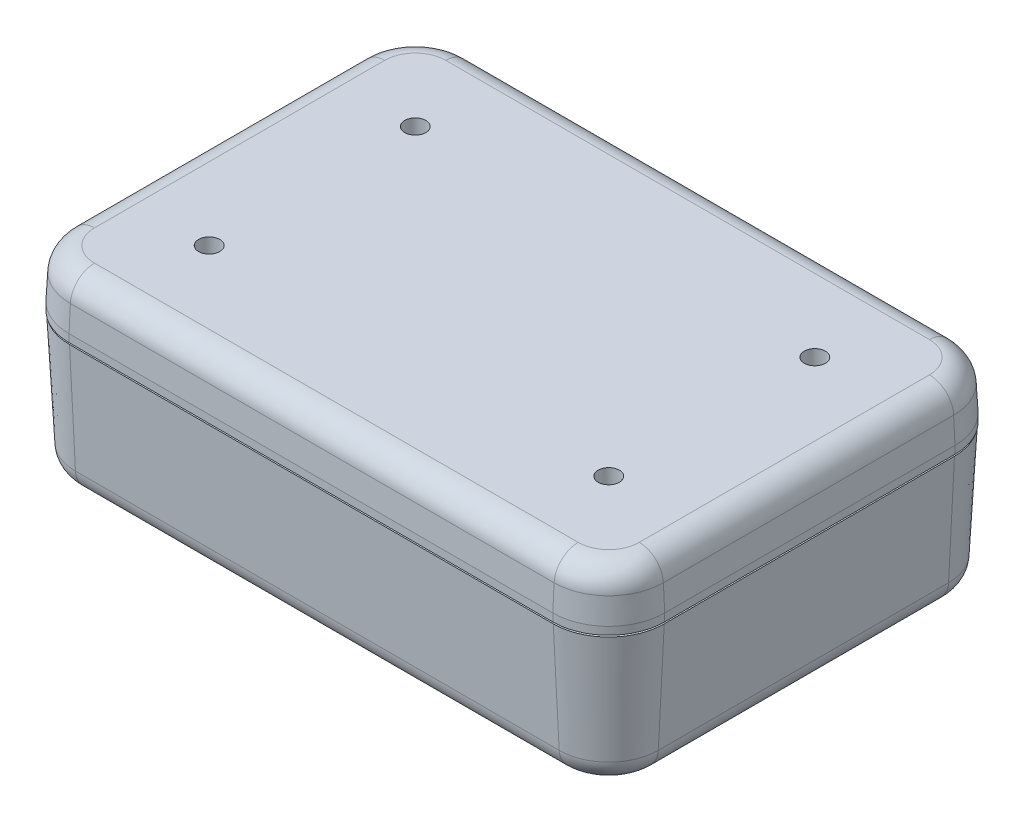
SolidWorks part; units mm, degrees
ref_plane "Front Plane" through (0, 0, 0) normal (0, 0, 1) x (1, 0, 0)
ref_plane "Top Plane" through (0, 0, 0) normal (0, 1, 0) x (1, 0, 0)
ref_plane "Right Plane" through (0, 0, 0) normal (1, 0, 0) x (0, 0, -1)
sketch "Sketch1" plane through (0, 0, 0) normal (0, 1, 0) x (1, 0, 0)
  line L1 (-63.5, -50.8) -> (63.5, -50.8)
  line L2 (-76.2, -38.1) -> (-76.2, 38.1)
  line L3 (-63.5, 50.8) -> (63.5, 50.8)
  line L4 (76.2, -38.1) -> (76.2, 38.1)
  line L5 (-76.2, -50.8) -> (76.2, 50.8) construction
  line L6 (-76.2, 50.8) -> (76.2, -50.8) construction
  arc A0 (-63.5, -50.8) -> (-76.2, -38.1) centre (-63.5, -38.1) cw
  arc A1 (63.5, -50.8) -> (76.2, -38.1) centre (63.5, -38.1) ccw
  arc A2 (63.5, 50.8) -> (76.2, 38.1) centre (63.5, 38.1) cw
  arc A3 (-76.2, 38.1) -> (-63.5, 50.8) centre (-63.5, 38.1) cw
  point P0 (0, 0)
  dimension "D1" = 12.7
  dimension "D3" = 152.4
  dimension "D4" = 101.6
extrude "Boss-Extrude1" add sketch "Sketch1" along normal blind 38.1 draft 3
fillet "Fillet1" radius 6.35 8 edges at (-72.4803, 0, 47.0803) (-76.2, 0, 0) (-72.4803, 0, -47.0803) (0, 0, -50.8) (72.4803, 0, -47.0803) (76.2, 0, 0) (72.4803, 0, 47.0803) (0, 0, 50.8)
shell "Shell1" thickness 3.175
sketch "Sketch2" plane through (0, 38.1, 0) normal (0, 1, 0) x (1, 0, 0)
  line L8 (-63.5, -52.7967) -> (63.5, -52.7967)
  line L9 (78.1967, -38.1) -> (78.1967, 38.1)
  line L10 (63.5, 52.7967) -> (-63.5, 52.7967)
  line L11 (-78.1967, 38.1) -> (-78.1967, -38.1)
  line L12 (-63.5, -52.7967) -> (63.5, -52.7967)
  line L13 (78.1967, -38.1) -> (78.1967, 38.1)
  line L14 (63.5, 52.7967) -> (-63.5, 52.7967)
  line L15 (-78.1967, 38.1) -> (-78.1967, -38.1)
  arc A8 (-78.1967, -38.1) -> (-63.5, -52.7967) centre (-63.5, -38.1) ccw
  arc A9 (63.5, -52.7967) -> (78.1967, -38.1) centre (63.5, -38.1) ccw
  arc A10 (78.1967, 38.1) -> (63.5, 52.7967) centre (63.5, 38.1) ccw
  arc A11 (-63.5, 52.7967) -> (-78.1967, 38.1) centre (-63.5, 38.1) ccw
  arc A12 (-78.1967, -38.1) -> (-63.5, -52.7967) centre (-63.5, -38.1) ccw
  arc A13 (63.5, -52.7967) -> (78.1967, -38.1) centre (63.5, -38.1) ccw
  arc A14 (78.1967, 38.1) -> (63.5, 52.7967) centre (63.5, 38.1) ccw
  arc A15 (-63.5, 52.7967) -> (-78.1967, 38.1) centre (-63.5, 38.1) ccw
  dimension "D1" = 0
extrude "Boss-Extrude2" add sketch "Sketch2" along normal blind 12.7 draft 3 separate body
fillet "Fillet2" radius 6.35 8 edges at (-73.4215, 50.8, 48.0215) (-77.5312, 50.8, 0) (-73.4215, 50.8, -48.0215) (0, 50.8, -52.1312) (73.4215, 50.8, -48.0215) (77.5312, 50.8, 0) (73.4215, 50.8, 48.0215) (0, 50.8, 52.1312)
shell "Shell2" thickness 3.175
ref_plane "Plane1" through (0, 38.1, 0) normal (0, 1, 0) x (1, 0, 0)
other "Lip&Groove2-Groove" parameters "GrooveHeight"=2.54, "GrooveWidth"=1.6002, "GrooveDraftAngle"=3, "Clearance"=0.381, "Gap"=0, "upGap"=2.032, "D7"=1.2192, "D8"=3, "D9"=0.508
other "Lip&Groove2-Lip" parameters "LipHeight"=2.032, "LipWidth"=1.2192, "LipDraftAngle"=3, "Clearance"=0.381, "Gap"=0, "upGap"=2.54, "D7"=1.6002, "D8"=3, "D9"=0.508
sketch3d "3DSketch1"
  point P0 (74.8717, 40.8789, 3.4814)
other "Snap Hook1" parameters "BaseDepth"=2.032, "TopDepth"=2.032, "Width"=3.81, "HookHeight"=6.35, "Overhang"=2.032, "BodyHeight"=10.16, "Draft"=3, "LipHeight"=0
sketch3d "3DSketch2"
  line L0 (71.5052, 47.625, 38.1) -> (71.5052, 47.625, -38.1) construction
  line L1 (63.5, 47.625, -46.1052) -> (-63.5, 47.625, -46.1052) construction
  point P0 (52.4552, 47.625, -27.0552)
  dimension "D1" = 19.05
  dimension "D2" = 19.05
other "Mounting Boss1" parameters "BossHeight"=11.938, "BossDiam"=7.874, "StepHeight"=1.524, "StepDia"=6.096, "HoleDiam"=3.302, "CBoreDiam"=5.08, "CBoreDepth"=1.524, "D8"=0, "D9"=0, "D10"=0, "Clearance"=0.254, "FinLength"=7.874, "FinWidth"=1.016, "FinHeight"=9.906, "ChamferDist"=2.3622, "BossDraft"=2, "HoleDraft"=1, "StepDraft"=0, "D19"=0, "FinDraft"=1, "ChamferAngle"=60
mirror "Mirror1" about plane through (0, 0, 0) normal (1, 0, 0) of "Mounting Boss1"
mirror "Mirror2" about plane through (0, 0, 0) normal (0, 0, 1) of "Mirror1", "Mounting Boss1"
